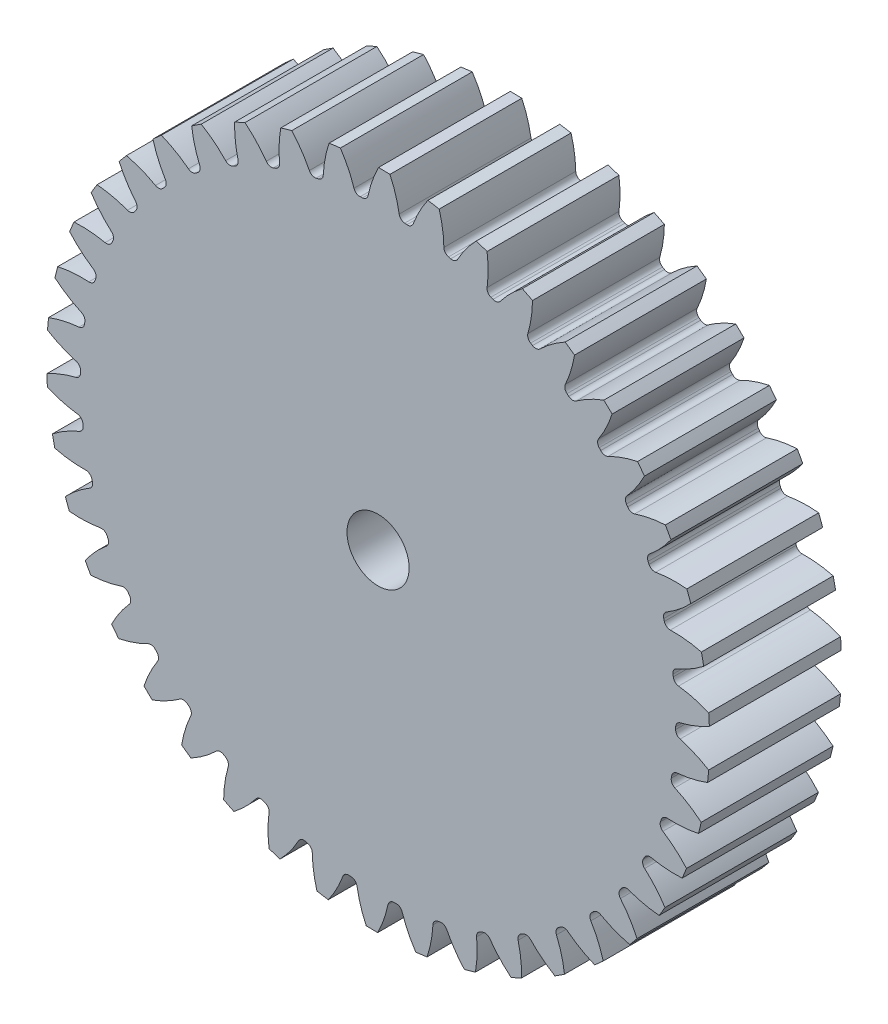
SolidWorks part; units mm, degrees
ref_plane "Front" through (0, 0, 0) normal (0, 0, 1) x (1, 0, 0)
ref_plane "Top" through (0, 0, 0) normal (0, 1, 0) x (1, 0, 0)
ref_plane "Right" through (0, 0, 0) normal (1, 0, 0) x (0, 0, -1)
sketch "Sketch3" plane through (0, 0, 0) normal (0, 0, 1) x (1, 0, 0)
  circle A0 centre (0, 0) radius 223.52
  dimension "od" = 447.04
extrude "gearBody" add sketch "Sketch3" along normal blind 88.9
sketch "Sketch2" plane through (0, 0, 0) normal (0, 0, 1) x (1, 0, 0)
  line L0 (0, 0) -> (185.2312, 76.7253) construction
  line L1 (223.0407, -17.0803) -> (0, 0) construction
  line L2 (0, 0) -> (36.3143, 0) construction
  line L3 (213.3225, 4.0008) -> (213.0283, -11.893) construction
  line L5 (213.1754, -3.9461) -> (0, 0) construction
  line L7 (0, 0) -> (200.4928, 0) construction
  arc A0 (200.4926, 0.2723) -> (200.3452, -7.6922) centre (0, 0) ccw construction
  arc A1 (223.3499, 8.7184) -> (222.8742, -16.9785) centre (0, 0) ccw construction
  arc A2 (213.3225, 4.0008) -> (213.0283, -11.893) centre (0, 0) ccw construction
  arc A3 (200.6101, -4.4769) -> (200.6383, -2.9507) centre (0, 0) ccw
  arc A4 (223.0407, -17.0803) -> (203.6119, -8.5462) centre (182.2647, -83.528) ccw
  arc A5 (223.0407, -17.0803) -> (223.52, 8.814) centre (0, 0) ccw
  arc A6 (223.52, 8.814) -> (203.7887, 1.0048) centre (185.2312, 76.7253) cw
  arc A7 (200.6383, -2.9507) -> (203.7887, 1.0048) centre (204.773, -3.0115) cw
  arc A8 (203.6119, -8.5462) -> (200.6101, -4.4769) centre (204.7441, -4.5691) cw
  point P6 (223.52, 8.814)
  point P22 (223.0407, -17.0803)
  dimension "baseDia" = 400.9856
  dimension "od" = 447.04
  dimension "pd" = 426.72
  dimension "rd" = 401.32
  dimension "rFillet" = 4.1351
  dimension "pointX" = 223.52
  dimension "pointY" = 8.814
  dimension "CTT" = 15.8937
  dimension "flankCenterAngle" = 22.5
extrude "toothCut" cut sketch "Sketch2" along normal through all
pattern_circular "CirPattern1" count 42 over 360 about axis through (0, 0, 0) along (0, 0, 1) of "toothCut"
sketch "hub1Dia" plane through (0, 0, 0) normal (0, 0, -1) x (-1, 0, 0)
  circle A0 centre (0, 0) radius 12.7
  dimension "hub1Dia" = 25.4
sketch "hub2Dia" plane through (0, 0, 88.9) normal (0, 0, 1) x (1, 0, 0)
  circle A0 centre (0, 0) radius 12.7
  dimension "hub2dia" = 25.4
sketch "boreDia" plane through (0, 0, 0) normal (0, 0, 1) x (1, 0, 0)
  circle A0 centre (0, 0) radius 20.955
  dimension "boreDia" = 41.91
extrude "bore" cut sketch "boreDia" against normal mid plane 25400
